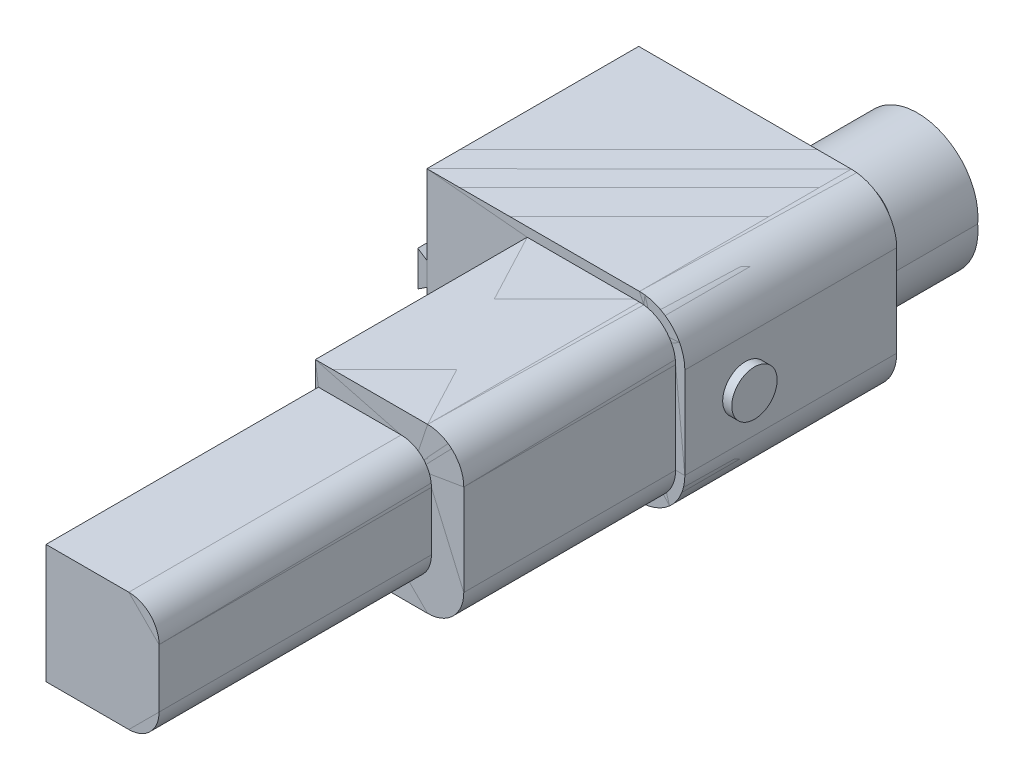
SolidWorks part; units mm, degrees
ref_plane "前基準面" through (0, 0, 0) normal (0, 0, 1) x (1, 0, 0)
ref_plane "上基準面" through (0, 0, 0) normal (0, 1, 0) x (1, 0, 0)
ref_plane "右基準面" through (0, 0, 0) normal (1, 0, 0) x (0, 0, -1)
imported_body "OCT.stp<1>"
sketch "草圖2" plane through (0, 0, -37.12) normal (0, 0, -1) x (-1, 0, 0)
  line L1 (-80.28, 55.4016) -> (-28.1848, 55.4016)
  line L2 (-80.28, 55.4016) -> (-80.28, 4.7131)
  line L3 (-80.28, 4.7131) -> (-28.1848, 4.7131)
  line L4 (-28.1848, 55.4016) -> (-28.1848, 4.7131)
extrude "除料-伸長1" cut sketch "草圖2" against normal up to surface (37.12 mm away)
sketch "草圖3" plane through (0, 0, 0) normal (0, 0, -1) x (-1, 0, 0)
  line L0 (-70.25, 60.2) -> (0, 60.2) construction
  line L1 (-70, 51.37) -> (-40, 51.37)
  line L2 (-80, 41.37) -> (-80, 11.37)
  line L3 (-70, 1.37) -> (-40, 1.37)
  line L4 (-30, 41.37) -> (-30, 11.37)
  line L5 (0, 0) -> (-70.25, 0) construction
  line L6 (0, 60.2) -> (0, 0) construction
  arc A0 (-70, 51.37) -> (-80, 41.37) centre (-70, 41.37) ccw
  arc A1 (-80, 11.37) -> (-70, 1.37) centre (-70, 11.37) ccw
  arc A2 (-40, 1.37) -> (-30, 11.37) centre (-40, 11.37) ccw
  arc A3 (-40, 51.37) -> (-30, 41.37) centre (-40, 41.37) cw
  point P10 (-80, 51.37)
  point P17 (-30, 51.37)
  dimension "D4" = 10
  dimension "D1" = 50
  dimension "D2" = 8.83
  dimension "D3" = 1.37
  dimension "D5" = 30
extrude "填料-伸長1" add sketch "草圖3" along normal blind 3.84
sketch "草圖4" plane through (0, 0, -3.84) normal (0, 0, -1) x (-1, 0, 0)
  line L0 (-40, 51.37) -> (-70, 51.37) construction
  line L1 (-30, 11.37) -> (-30, 41.37) construction
  circle A0 centre (-55, 26.37) radius 22
  point P4 (-55, 51.37)
  point P7 (-30, 26.37)
  dimension "D1" = 44
extrude "填料-伸長2" add sketch "草圖4" along normal blind 4.16
sketch "草圖5" plane through (0, 0, -8) normal (0, 0, -1) x (-1, 0, 0)
  circle A0 centre (-55, 26.37) radius 20
  dimension "D1" = 40
extrude "填料-伸長3" add sketch "草圖5" along normal blind 29.12
sketch "Sketch1" plane through (0, 0, 0) normal (-1, 0, 0) x (0, 0, 1)
  line L0 (0, 30.1) -> (70, 30.1) construction
  line L1 (0, 60.2) -> (0, 0) construction
  line L2 (70, 60.2) -> (70, 0) construction
  line L3 (70, 26.24) -> (70, 33.96)
  line L4 (70, 3.05) -> (70, 57.15) construction
  line L5 (70, 33.96) -> (7.35, 33.96) construction
  line L6 (7.35, 33.96) -> (7.35, 26.24) construction
  line L7 (7.35, 26.24) -> (70, 26.24) construction
  line L8 (9.85, 33.96) -> (9.85, 26.24) construction
  line L9 (17.35, 33.96) -> (17.35, 26.24) construction
  line L10 (14.85, 33.96) -> (14.85, 26.24) construction
  line L11 (17.35, 33.96) -> (70, 33.96)
  line L12 (17.35, 26.24) -> (70, 26.24)
  spline S0 degree 2 poles (7.35, 30.1) (11.3857, 34.0027) (17.35, 33.96) knots 0 0 0 1 1 1
  spline S1 degree 2 poles (7.35, 30.1) (11.3857, 26.1973) (17.35, 26.24) knots 0 0 0 1 1 1
  point P11 (70, 30.1)
  point P15 (9.85, 30.1)
  point P16 (9.85, 32.03)
  point P17 (9.85, 28.17)
  dimension "D8" = 7.5
  dimension "D1" = 62.65
  dimension "D2" = 7.72
  dimension "D3" = 3.86
  dimension "D4" = 2.5
  dimension "D5" = 1.93
  dimension "D6" = 1.93
  dimension "D7" = 10
ref_plane "Plane1" through (-3, 0, 0) normal (-1, 0, 0) x (0, 0, 1)
sketch "Sketch2" plane through (-3, 0, 0) normal (-1, 0, 0) x (0, 0, 1)
  line L0 (70, 30.1) -> (0, 30.1) construction
  line L1 (70, 30.1) -> (70, 35.94)
  line L2 (70, 60.2) -> (70, 0) construction
  line L3 (70, 30.1) -> (70, 24.26)
  line L4 (70, 35.94) -> (5.35, 35.94) construction
  line L5 (5.35, 35.94) -> (5.35, 24.26) construction
  line L6 (5.35, 24.26) -> (70, 24.26) construction
  line L7 (7.85, 35.94) -> (7.85, 24.26) construction
  line L8 (12.85, 35.94) -> (12.85, 24.26) construction
  line L9 (15.35, 35.94) -> (15.35, 24.26) construction
  line L10 (15.35, 35.94) -> (70, 35.94)
  line L11 (15.35, 24.26) -> (70, 24.26)
  spline S0 degree 2 poles (5.35, 30.1) (8.6761, 35.3796) (15.35, 35.94) knots 0 0 0 1 1 1
  spline S1 degree 2 poles (5.35, 30.1) (8.6761, 24.8204) (15.35, 24.26) knots 0 0 0 1 1 1
  point P16 (9.85, 30.1)
  point P17 (7.85, 33.02)
  point P19 (7.85, 27.18)
  dimension "D1" = 5.84
  dimension "D2" = 5.84
  dimension "D3" = 2.5
  dimension "D4" = 7.5
  dimension "D5" = 10
  dimension "D6" = 2.92
  dimension "D7" = 2.92
  dimension "D8" = 64.65
ref_plane "Plane2" through (0, 30.1, 0) normal (0, -1, 0) x (-1, 0, 0)
sketch "Sketch3" plane through (0, 30.1, 0) normal (0, -1, 0) x (-1, 0, 0)
  line L0 (0, -7.35) -> (3, -5.35)
sketch "Sketch4" plane through (0, 0, 70) normal (0, 0, 1) x (1, 0, 0)
  line L0 (0, 33.96) -> (-3, 35.94)
  line L1 (0, 26.24) -> (-3, 24.26)
loft "Loft1" add profiles "Sketch2", "Sketch1"
ref_plane "Plane3" through (70.25, 0, 70) normal (1, 0, 0) x (0, 0, -1)
sketch "Sketch6" plane through (0, 0, 70) normal (0, 0, 1) x (1, 0, 0)
  line L9 (85.25, 15) -> (85.25, 45.2)
  line L10 (70.25, 60.2) -> (0, 60.2)
  line L11 (0, 60.2) -> (0, 33.96)
  line L12 (0, 33.96) -> (-3, 35.94)
  line L13 (-3, 35.94) -> (-3, 30.1)
  line L14 (-3, 30.1) -> (-3, 24.26)
  line L15 (-3, 24.26) -> (0, 26.24)
  line L16 (0, 26.24) -> (0, 0)
  line L17 (0, 0) -> (70.25, 0)
  line L18 (85.25, 15) -> (85.25, 45.2)
  line L19 (70.25, 60.2) -> (0, 60.2)
  line L20 (0, 60.2) -> (0, 33.96)
  line L21 (0, 33.96) -> (-3, 35.94)
  line L22 (-3, 35.94) -> (-3, 30.1)
  line L23 (-3, 30.1) -> (-3, 24.26)
  line L24 (-3, 24.26) -> (0, 26.24)
  line L25 (0, 26.24) -> (0, 0)
  line L26 (0, 0) -> (70.25, 0)
  arc A2 (70.25, 0) -> (85.25, 15) centre (70.25, 15) ccw
  arc A3 (85.25, 45.2) -> (70.25, 60.2) centre (70.25, 45.2) ccw
  arc A4 (70.25, 0) -> (85.25, 15) centre (70.25, 15) ccw
  arc A5 (85.25, 45.2) -> (70.25, 60.2) centre (70.25, 45.2) ccw
  dimension "D1" = 0
sketch "Sketch7" plane through (0, 0, 140) normal (0, 0, 1) x (1, 0, 0)
  line L4 (82.2, 15) -> (82.2, 45.2)
  line L5 (70.25, 57.15) -> (33.15, 57.15)
  line L6 (33.15, 57.15) -> (33.15, 3.05)
  line L7 (33.15, 3.05) -> (70.25, 3.05)
  line L8 (82.2, 15) -> (82.2, 45.2)
  line L9 (70.25, 57.15) -> (33.15, 57.15)
  line L10 (33.15, 57.15) -> (33.15, 3.05)
  line L11 (33.15, 3.05) -> (70.25, 3.05)
  arc A2 (82.2, 45.2) -> (70.25, 57.15) centre (70.25, 45.2) ccw
  arc A3 (70.25, 3.05) -> (82.2, 15) centre (70.25, 15) ccw
  arc A4 (82.2, 45.2) -> (70.25, 57.15) centre (70.25, 45.2) ccw
  arc A5 (70.25, 3.05) -> (82.2, 15) centre (70.25, 15) ccw
  dimension "D1" = 0
sketch "Sketch8" plane through (0, 0, 0) normal (0, 0, -1) x (-1, 0, 0)
  line L0 (-80, 41.37) -> (-80, 11.37) construction
  line L1 (-70, 1.37) -> (-40, 1.37) construction
  line L2 (-30, 11.37) -> (-30, 41.37) construction
  line L3 (-40, 51.37) -> (-70, 51.37) construction
  line L4 (-80, 41.37) -> (-80, 11.37)
  line L5 (-70, 1.37) -> (-40, 1.37)
  line L6 (-30, 11.37) -> (-30, 41.37)
  line L7 (-40, 51.37) -> (-70, 51.37)
  arc A0 (-80, 11.37) -> (-70, 1.37) centre (-70, 11.37) ccw construction
  arc A1 (-40, 1.37) -> (-30, 11.37) centre (-40, 11.37) ccw construction
  arc A2 (-30, 41.37) -> (-40, 51.37) centre (-40, 41.37) ccw construction
  arc A3 (-70, 51.37) -> (-80, 41.37) centre (-70, 41.37) ccw construction
  arc A4 (-80, 11.37) -> (-70, 1.37) centre (-70, 11.37) ccw
  arc A5 (-40, 1.37) -> (-30, 11.37) centre (-40, 11.37) ccw
  arc A6 (-30, 41.37) -> (-40, 51.37) centre (-40, 41.37) ccw
  arc A7 (-70, 51.37) -> (-80, 41.37) centre (-70, 41.37) ccw
